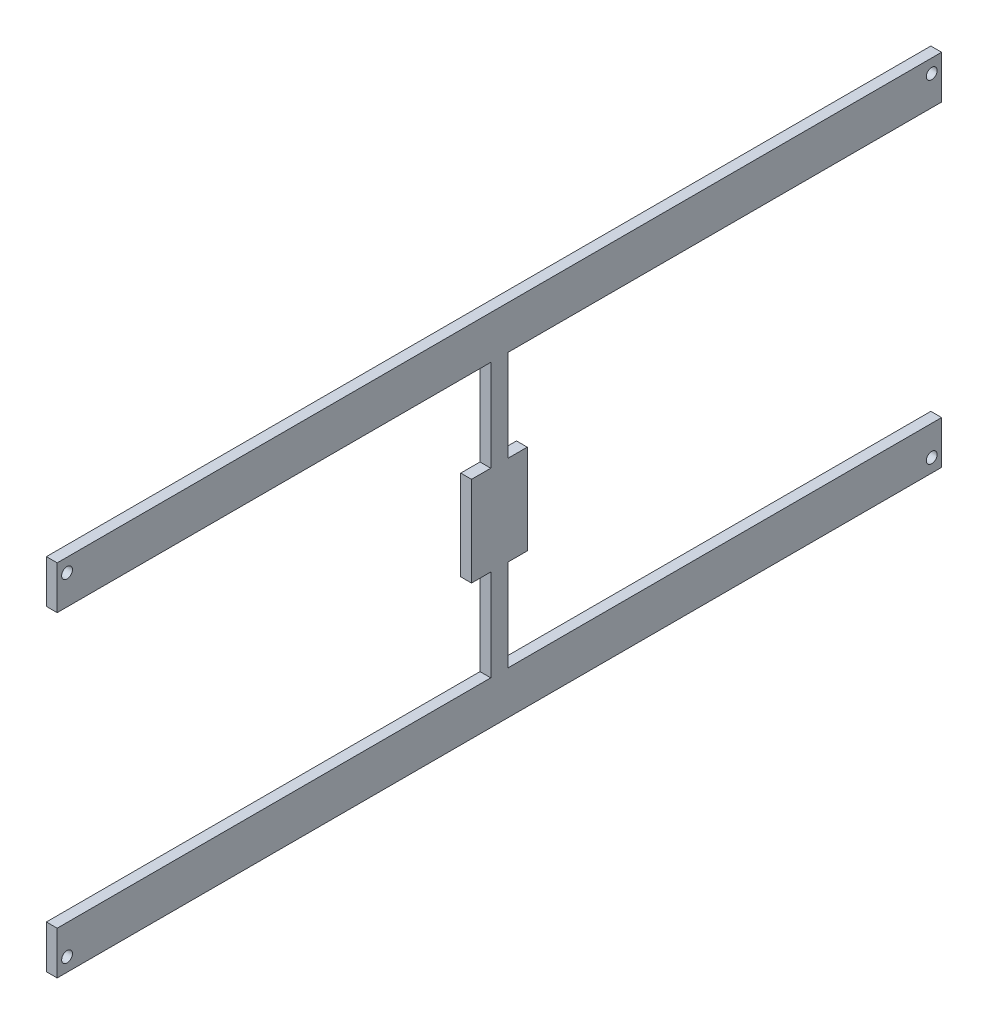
SolidWorks part; units mm, degrees
ref_plane "Ebene vorne" through (0, 0, 0) normal (0, 0, 1) x (1, 0, 0)
ref_plane "Ebene oben" through (0, 0, 0) normal (0, 1, 0) x (1, 0, 0)
ref_plane "Ebene rechts" through (0, 0, 0) normal (1, 0, 0) x (0, 0, -1)
sketch "Skizze1" plane through (0, 0, 0) normal (1, 0, 0) x (0, 0, -1)
  line L0 (0, 154.103) -> (0, -192.9645) construction
  line L1 (123, 14.8983) -> (2.4, 14.8983)
  line L2 (123, 14.8983) -> (123, 2.8983)
  line L3 (123, 2.8983) -> (2.4, 2.8983)
  line L4 (-123, 14.8983) -> (-123, 2.8983)
  line L5 (-8.1584, 14.8983) -> (-3.1584, 14.8983) construction
  line L6 (-8.1584, -85.1017) -> (-3.1584, -85.1017) construction
  line L7 (123, -85.1017) -> (2.4, -85.1017)
  line L8 (123, -85.1017) -> (123, -73.1017)
  line L9 (123, -73.1017) -> (2.4, -73.1017)
  line L10 (-123, -85.1017) -> (-123, -73.1017)
  line L11 (120.25, 11.1483) -> (120.25, -81.3517) construction
  line L12 (-120.25, 2.8983) -> (-120.25, -73.1017) construction
  line L13 (-120.25, -35.1017) -> (120.25, -35.1017) construction
  line L14 (-120.25, 2.8983) -> (-120.25, 11.1483) construction
  line L15 (-120.25, -73.1017) -> (-120.25, -81.3517) construction
  line L17 (-2.4, -73.1017) -> (-123, -73.1017)
  line L18 (-2.4, -22.6017) -> (-7.75, -22.6017)
  line L19 (2.4, 2.8983) -> (2.4, -22.6017)
  line L20 (-2.4, 2.8983) -> (-123, 2.8983)
  line L21 (-2.4, 2.8983) -> (-2.4, -22.6017)
  line L22 (7.75, -47.6017) -> (2.4, -47.6017)
  line L23 (7.75, -47.6017) -> (7.75, -22.6017)
  line L24 (7.75, -22.6017) -> (2.4, -22.6017)
  line L25 (-7.75, -47.6017) -> (-7.75, -22.6017)
  line L26 (7.75, -47.6017) -> (-7.75, -22.6017) construction
  line L27 (7.75, -22.6017) -> (-7.75, -47.6017) construction
  line L28 (-2.4, -47.6017) -> (-7.75, -47.6017)
  line L29 (2.4, -47.6017) -> (2.4, -73.1017)
  line L30 (-2.4, -47.6017) -> (-2.4, -73.1017)
  line L35 (2.4, 14.8983) -> (-123, 14.8983)
  line L40 (2.4, -85.1017) -> (-123, -85.1017)
  circle A0 centre (120.25, 11.1483) radius 1.5
  circle A1 centre (120.25, -81.3517) radius 1.5
  circle A2 centre (-120.25, 11.1483) radius 1.5
  circle A3 centre (-120.25, -81.3517) radius 1.5
  point P4 (0, 14.8983)
  point P11 (0, 8.8983)
  point P14 (0, -85.1017)
  point P23 (120.25, -35.1017)
  point P26 (0, -35.1017)
  point P35 (0, -73.1017)
  point P36 (0, -35.1017)
  dimension "D4" = 3
  dimension "D1" = 12
  dimension "D2" = 246
  dimension "D3" = 92.5
  dimension "D5" = 240.5
  dimension "D6" = 4.8
  dimension "D7" = 15.5
  dimension "D8" = 25
extrude "Aufsatz-Linear austragen1" add sketch "Skizze1" along normal blind 3
